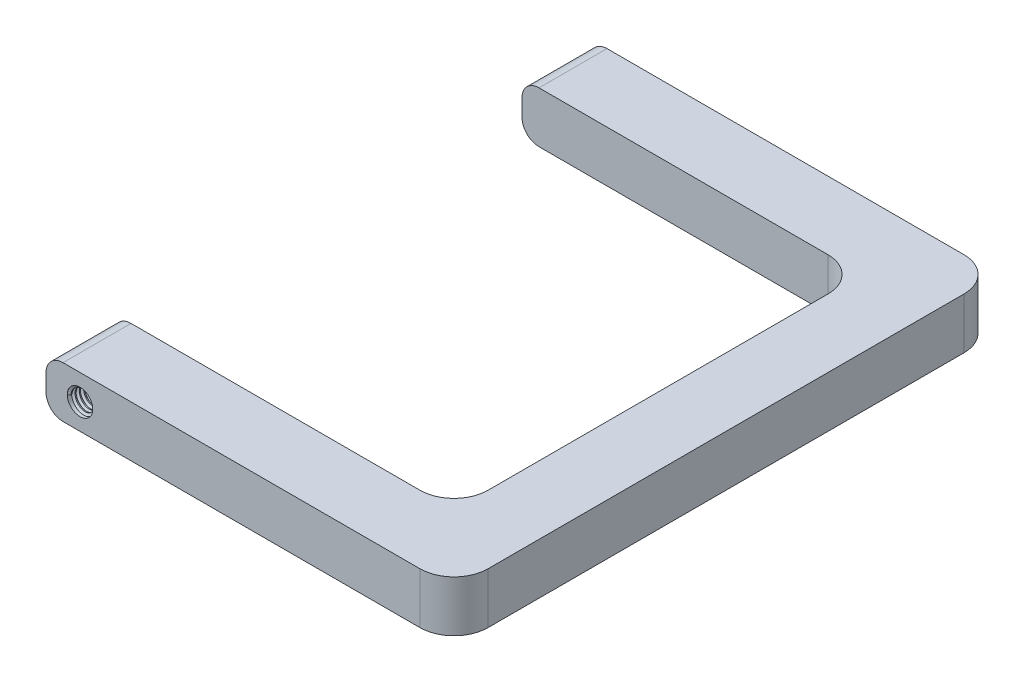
SolidWorks part; units mm, degrees
ref_plane "Front Plane" through (0, 0, 0) normal (0, 0, 1) x (1, 0, 0)
ref_plane "Top Plane" through (0, 0, 0) normal (0, 1, 0) x (1, 0, 0)
ref_plane "Right Plane" through (0, 0, 0) normal (1, 0, 0) x (0, 0, -1)
sketch "Sketch1" plane through (0, 0, 0) normal (0, 1, 0) x (1, 0, 0)
  line L1 (-76.2, -101.6) -> (76.2, -101.6)
  line L2 (-76.2, -101.6) -> (-76.2, 101.6)
  line L3 (-76.2, 101.6) -> (76.2, 101.6)
  line L4 (76.2, -101.6) -> (76.2, 101.6)
  line L5 (-76.2, -101.6) -> (76.2, 101.6) construction
  line L6 (-76.2, 101.6) -> (76.2, -101.6) construction
  point P0 (0, 0)
  dimension "D1" = 203.2
  dimension "D2" = 152.4
extrude "Boss-Extrude1" add sketch "Sketch1" along normal blind 19.05
sketch "Sketch2" plane through (0, 19.05, 0) normal (0, 1, 0) x (1, 0, 0)
  line L0 (-76.2, 101.6) -> (-76.2, -101.6) construction
  line L1 (-76.2, 76.2) -> (50.8, 76.2)
  line L2 (-76.2, 76.2) -> (-76.2, -76.2)
  line L3 (-76.2, -76.2) -> (50.8, -76.2)
  line L4 (50.8, 76.2) -> (50.8, -76.2)
  line L5 (-76.2, -101.6) -> (76.2, -101.6) construction
  dimension "D1" = 152.4
  dimension "D2" = 127
  dimension "D3" = 25.4
extrude "Cut-Extrude1" cut sketch "Sketch2" against normal through all
fillet "Fillet1" radius 12.7 2 edges at (76.2, 9.525, 101.6) (76.2, 9.525, -101.6)
fillet "Fillet2" radius 12.7 2 edges at (50.8, 9.525, 76.2) (50.8, 9.525, -76.2)
fillet "Fillet3" radius 6.35 4 edges at (-76.2, 0, 88.9) (-76.2, 19.05, 88.9) (-76.2, 0, -88.9) (-76.2, 19.05, -88.9)
sketch "Sketch3" plane through (0, 0, 101.6) normal (0, 0, 1) x (1, 0, 0)
  line L0 (-69.85, 19.05) -> (63.5, 19.05) construction
  line L2 (-76.2, 12.7) -> (-76.2, 6.35) construction
  circle A0 centre (-63.5, 9.525) radius 4.7625
  point P2 (0, 0)
  point P7 (-76.2, 9.0278)
  point P8 (0, 0)
  dimension "D1" = 9.525
  dimension "D2" = 12.7
extrude "Cut-Extrude2" cut sketch "Sketch3" against normal up to next
thread "Thread1" pitch 1.5875 start angle 0, offset 0, length 25.4, pitch 1.5875, diameter 9.525
ref_plane "Plane2" through (-68.2625, 9.525, 101.6) normal (0, -1, 0) x (-1, 0, 0)
sketch "Thread Profile2" plane through (-68.2625, 9.525, 101.6) normal (0, -1, 0) x (-1, 0, 0)
  line L0 (0, 0) -> (0, 1.5875) construction
  line L11 (0, 0) -> (0, 1.3891)
  line L12 (0, 1.3891) -> (-0.8593, 0.893)
  line L13 (-0.8593, 0.893) -> (-0.8593, 0.4961)
  line L15 (-0.8593, 0.4961) -> (0, 0)
  line L17 (-0.8593, 0.6945) -> (0, 0.6945) construction
  point P2 (0, 0)
  dimension "Pitch" = 1.5875
  dimension "Profile_Angle" = 60
  dimension "Profile_Land" = 0.3969
  dimension "Profile_Height" = 0.8593
